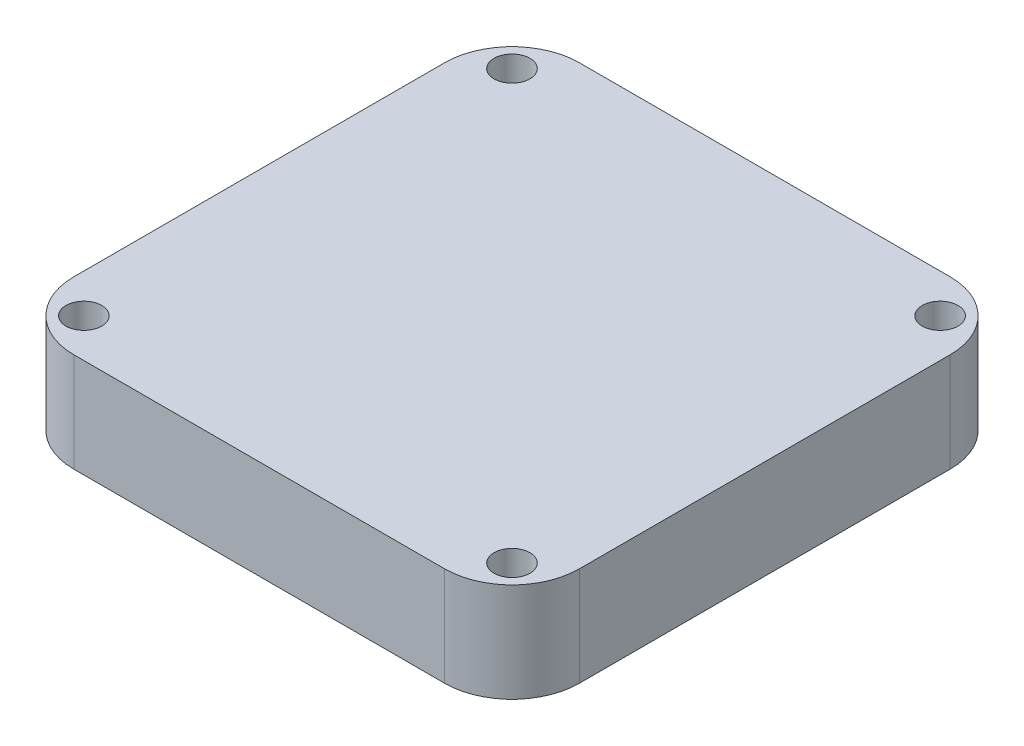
SolidWorks part; units mm, degrees
ref_plane "Front Plane" through (0, 0, 0) normal (0, 0, 1) x (1, 0, 0)
ref_plane "Top Plane" through (0, 0, 0) normal (0, 1, 0) x (1, 0, 0)
ref_plane "Right Plane" through (0, 0, 0) normal (1, 0, 0) x (0, 0, -1)
sketch "Sketch1" plane through (0, 0, 0) normal (0, 1, 0) x (1, 0, 0)
  line L1 (37.5, -37.5) -> (-37.5, -37.5)
  line L2 (37.5, -37.5) -> (37.5, 37.5)
  line L3 (37.5, 37.5) -> (-37.5, 37.5)
  line L4 (-37.5, -37.5) -> (-37.5, 37.5)
  line L5 (37.5, -37.5) -> (-37.5, 37.5) construction
  line L6 (37.5, 37.5) -> (-37.5, -37.5) construction
  point P0 (0, 0)
  dimension "D1" = 75
extrude "Boss-Extrude1" add sketch "Sketch1" along normal blind 14.7
hole_wizard "#4 (0.209) Diameter Hole1" positions "Sketch3" profile "Sketch2" hole size "#4" standard "ANSI Inch"
sketch "Sketch3" plane through (0, 14.7, 0) normal (0, 1, 0) x (1, 0, 0)
  line L1 (31.75, -31.75) -> (-31.75, -31.75)
  line L2 (31.75, -31.75) -> (31.75, 31.75)
  line L3 (31.75, 31.75) -> (-31.75, 31.75)
  line L4 (-31.75, -31.75) -> (-31.75, 31.75)
  line L5 (31.75, -31.75) -> (-31.75, 31.75) construction
  line L6 (31.75, 31.75) -> (-31.75, -31.75) construction
  point P2 (-31.75, 31.75)
  point P5 (31.75, -31.75)
  point P6 (31.75, 31.75)
  point P7 (-31.75, -31.75)
  dimension "D1" = 63.5
sketch "Sketch2" plane through (-31.75, 14.7, -31.75) normal (1, 0, 0) x (0, 0, 1)
  line L0 (0, 0) -> (0, 14.7)
  line L1 (0, 14.7) -> (2.6543, 14.7)
  line L2 (2.6543, 14.7) -> (2.6543, 0)
  line L5 (2.6543, 0) -> (0, 0)
  line L11 (0, -6.35) -> (0, 107.95) construction
  dimension "Thru Hole Dia." = 5.3086
  dimension "Thru Hole Depth" = 14.7
fillet "Fillet1" radius 10 4 edges at (-37.5, 7.35, -37.5) (37.5, 7.35, -37.5) (37.5, 7.35, 37.5) (-37.5, 7.35, 37.5)
